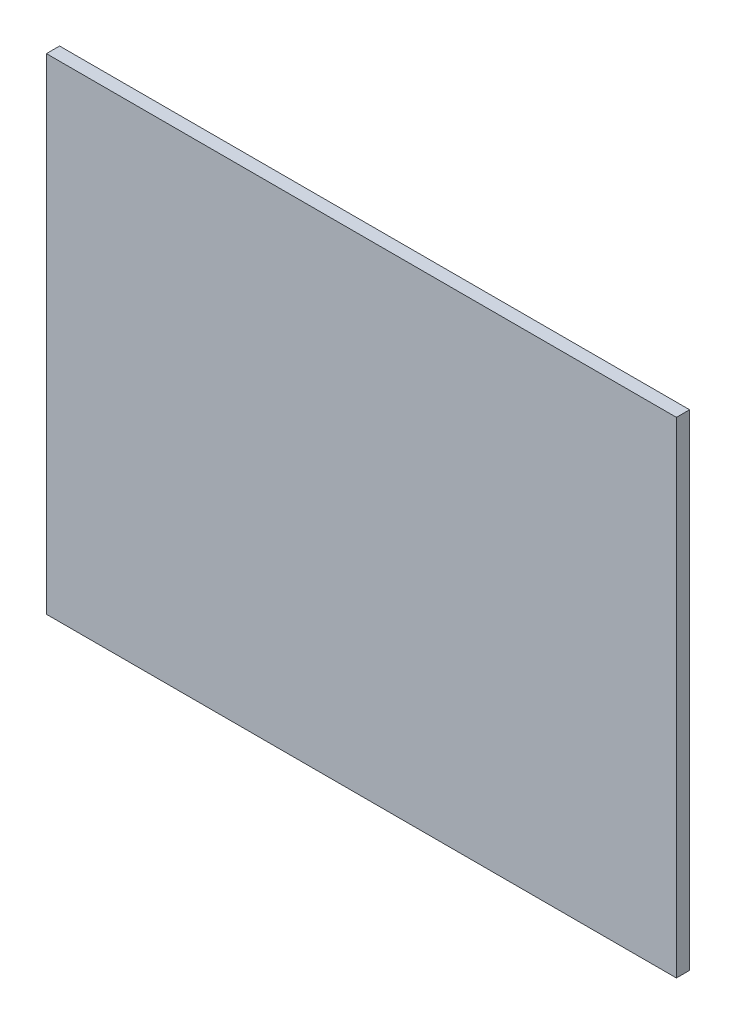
SolidWorks part; units mm, degrees
ref_plane "Plan de face" through (0, 0, 0) normal (0, 0, 1) x (1, 0, 0)
ref_plane "Plan de dessus" through (0, 0, 0) normal (0, 1, 0) x (1, 0, 0)
ref_plane "Plan de droite" through (0, 0, 0) normal (1, 0, 0) x (0, 0, -1)
sketch "Esquisse1" plane through (0, 0, 0) normal (0, 0, 1) x (1, 0, 0)
  line L1 (0, 0) -> (477.9821, 0)
  line L2 (0, 0) -> (0, -368.3871)
  line L3 (0, -368.3871) -> (477.9821, -368.3871)
  line L4 (477.9821, 0) -> (477.9821, -368.3871)
extrude "Boss.-Extru.1" add sketch "Esquisse1" along normal blind 10
